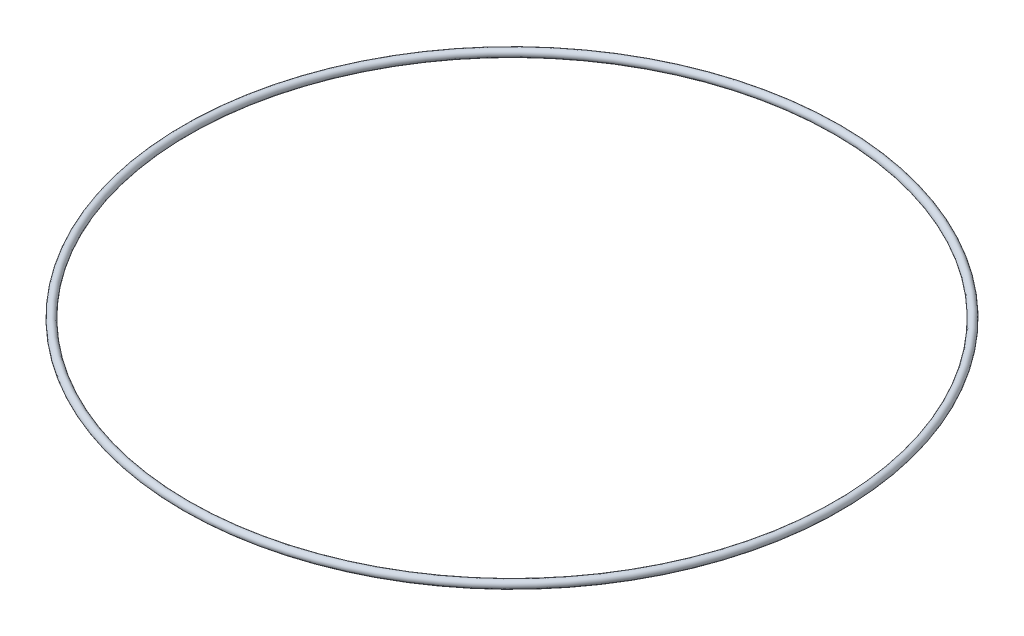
SolidWorks part; units mm, degrees
ref_plane "Plan1" through (0, 0, 0) normal (0, 0, 1) x (1, 0, 0)
ref_plane "Plan2" through (0, 0, 0) normal (0, 1, 0) x (1, 0, 0)
ref_plane "Plan3" through (0, 0, 0) normal (1, 0, 0) x (0, 0, -1)
sketch "Esquisse1" plane through (0, 0, 0) normal (0, 0, 1) x (1, 0, 0)
  line L1 (0, 0) -> (251, 0) construction
  line L2 (0, 1.5) -> (0, -1.5) construction
  circle A0 centre (127, 0) radius 1.5
  dimension "D2" = 127
  dimension "D1" = 3
  dimension "Diamètre du tore" = 3
  dimension "Diamètre intérieur" = 251
revolve "Base-Révolution" add sketch "Esquisse1" angle 360 about L2
equation " \"D1@Esquisse1\"=\"Diamètre du tore@Esquisse1\" "
equation "\"D2@Esquisse1\" = (\"Diamètre intérieur@Esquisse1\"/2)+(\"Diamètre du tore@Esquisse1\"/2)"
